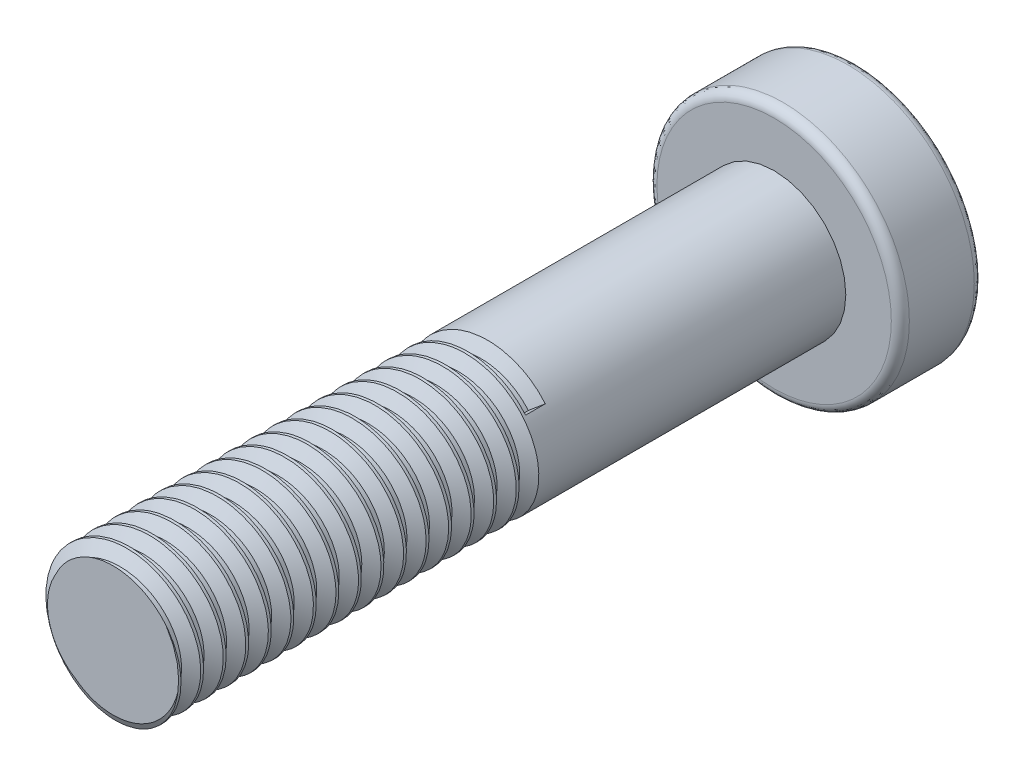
SolidWorks part; units mm, degrees
ref_plane "Ebene vorne" through (0, 0, 0) normal (0, 0, 1) x (1, 0, 0)
ref_plane "Ebene oben" through (0, 0, 0) normal (0, 1, 0) x (1, 0, 0)
ref_plane "Ebene rechts" through (0, 0, 0) normal (1, 0, 0) x (0, 0, -1)
sketch "Skizze1" plane through (0, 0, 0) normal (0, 0, 1) x (1, 0, 0)
  circle A0 centre (0, 0) radius 3.975
  dimension "D1" = 7.95
extrude "Aufsatz-Linear austragen1" add sketch "Skizze1" along normal blind 40
sketch "Skizze2" plane through (0, 0, 0) normal (0, 0, -1) x (-1, 0, 0)
  circle A0 centre (0, 0) radius 7
  dimension "D1" = 14
extrude "Aufsatz-Linear austragen2" add sketch "Skizze2" along normal blind 4.6
sketch "Skizze3" plane through (0, 0, -4.6) normal (0, 0, -1) x (-1, 0, 0)
  circle A0 centre (0, 0) radius 2.25
  dimension "D1" = 4.5
extrude "Schnitt-Linear austragen1" cut sketch "Skizze3" against normal blind 23
thread "Gewinde1" pitch 1.25 start angle 0, offset 0, length 23, pitch 1.25, diameter 7.95
ref_plane "Ebene1" through (-3.975, 0, 40) normal (0, -1, 0) x (-1, 0, 0)
sketch "Gewindeprofil1" plane through (-3.975, 0, 40) normal (0, -1, 0) x (-1, 0, 0)
  line L0 (0, 0) -> (0, 1.25) construction
  line L11 (0, 0) -> (0, 1.0937)
  line L12 (0, 1.0937) -> (-0.6766, 0.7031)
  line L13 (-0.6766, 0.7031) -> (-0.6766, 0.3906)
  line L15 (-0.6766, 0.3906) -> (0, 0)
  line L17 (-0.6766, 0.5469) -> (0, 0.5469) construction
  point P2 (0, 0)
  dimension "Pitch" = 1.25
  dimension "Profile_Angle" = 60
  dimension "Profile_Land" = 0.3125
  dimension "Profile_Height" = 0.6766
sketch "Skizze9" plane through (0, 0, 40) normal (0, 0, 1) x (1, 0, 0)
  circle A0 centre (0, 0) radius 4.4394
extrude "Schnitt-Linear austragen2" cut sketch "Skizze9" against normal blind 3
fillet "Verrundung1" radius 0.5 2 edges at (-7, 0, -4.6) (-7, 0, 0)
